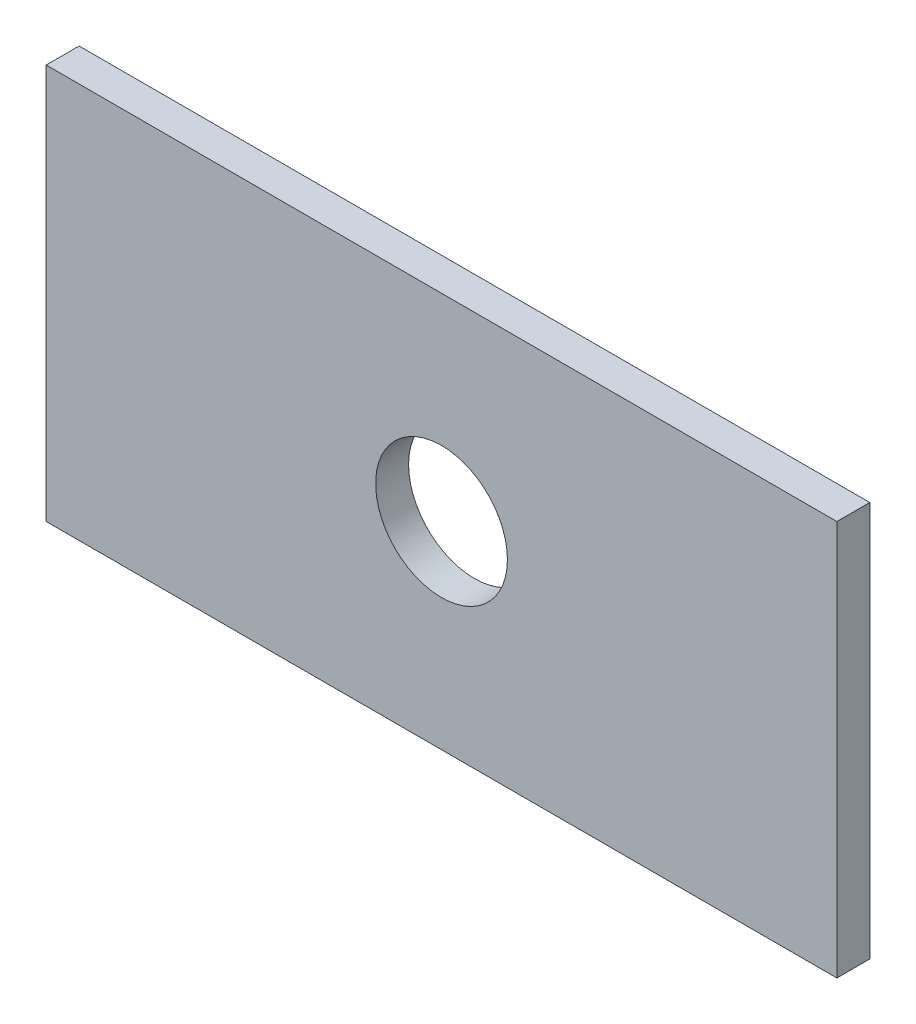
SolidWorks part; units mm, degrees
ref_plane "Vorne" through (0, 0, 0) normal (0, 0, 1) x (1, 0, 0)
ref_plane "Oben" through (0, 0, 0) normal (0, 1, 0) x (1, 0, 0)
ref_plane "Links" through (0, 0, 0) normal (1, 0, 0) x (0, 0, -1)
sketch "Skizze1" plane through (0, 0, 0) normal (0, 0, 1) x (1, 0, 0)
  line L1 (0, 0) -> (120, 0)
  line L2 (0, 0) -> (0, 60)
  line L3 (0, 60) -> (120, 60)
  line L4 (120, 0) -> (120, 60)
  dimension "D1" = 120
  dimension "D2" = 60
extrude "Linear austragen1" add sketch "Skizze1" along normal blind 5
hole_wizard "Durchgangsloch für M61" positions "Skizze3" profile "Skizze2" hole standard "Ansi Metrisch"
sketch "Skizze3" plane through (0, 0, 5) normal (0, 0, 1) x (1, 0, 0)
  line L0 (0, 60) -> (0, 0) construction
  line L1 (120, 60) -> (0, 60) construction
  point P0 (60, 30)
  dimension "D1" = 60
  dimension "D2" = 30
sketch "Skizze2" plane through (60, 30, 5) normal (1, 0, 0) x (0, -1, 0)
  line L0 (0, 0) -> (0, 100)
  line L1 (0, 100) -> (10, 100)
  line L2 (10, 100) -> (10, 0)
  line L3 (10, 0) -> (0, 0)
  line L4 (0, 110) -> (0, -10) construction
  dimension "Durchmesser" = 20
  dimension "Tiefe" = 100
